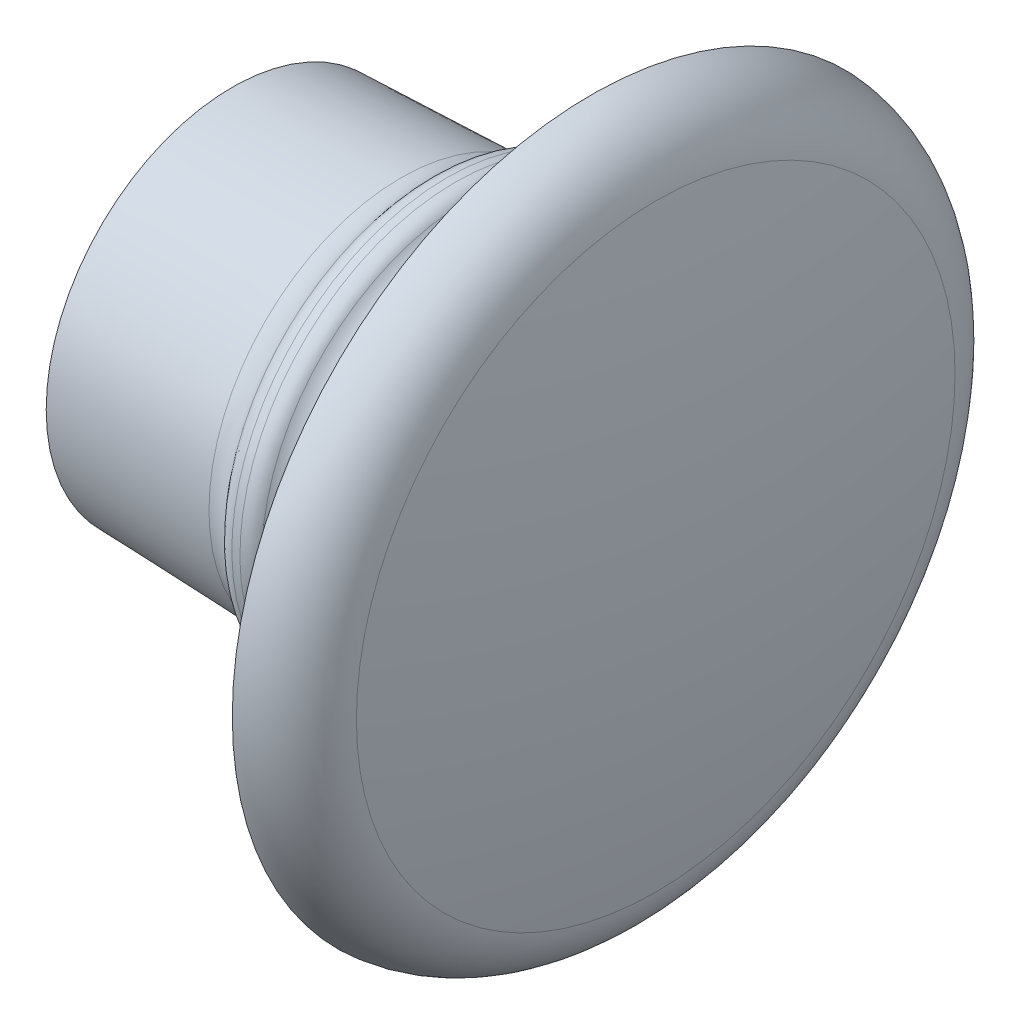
SolidWorks part; units mm, degrees
ref_plane "Plan1" through (0, 0, 0) normal (0, 0, 1) x (1, 0, 0)
ref_plane "Plan2" through (0, 0, 0) normal (0, 1, 0) x (1, 0, 0)
ref_plane "Plan3" through (0, 0, 0) normal (1, 0, 0) x (0, 0, -1)
sketch "Esquisse1" plane through (0, 0, 0) normal (1, 0, 0) x (0, 0, -1)
  circle A0 centre (0, 0) radius 5.35
  dimension "D1" = 10.7
extrude "Base-Extrusion" add sketch "Esquisse1" along normal blind 10
sketch "Esquisse7"
  line L0 (0, 0) -> (30, 0) construction
  line L1 (10, 10) -> (11.4898, 10)
  line L2 (10, 0) -> (10, 10)
  line L3 (12.5, 0) -> (10, 0)
  line L4 (10, -5.35) -> (10, 5.35) construction
  line L8 (10, 0) -> (0, 0) construction
  arc A0 (11.4898, 10) -> (12.5, 0) centre (-37.5, 0) cw
revolve "Boss.-Révol.1" add sketch "Esquisse5" angle 360 about L0
sketch "Esquisse5" plane through (0, 0, 0) normal (0, 0, 1) x (1, 0, 0)
  line L0 (-2.7996, 0) -> (20, 0) construction
  line L2 (-1.3, 0) -> (-1.5, 0) construction
  line L3 (10, 5.35) -> (0, 5.35) construction
  line L4 (10, 5.35) -> (7.5, 5.35)
  line L5 (4.7, 5.35) -> (0, 5.35)
  line L6 (0, 5.35) -> (0, 0)
  line L8 (10, -7.95) -> (10, 7.95) construction
  line L9 (0, 5.35) -> (0, -5.35) construction
  line L10 (10, 0) -> (10, 5.35)
  line L11 (10, 0) -> (0, 0)
  line L13 (5.7037, 6) -> (6.4963, 6)
  arc A1 (6.4, 6.45) -> (7.5, 5.35) centre (7.5, 6.45) ccw construction
  arc A3 (6.4963, 6) -> (7.5, 5.35) centre (7.5, 6.45) ccw
  arc A5 (4.7, 5.35) -> (5.8, 6.45) centre (4.7, 6.45) ccw construction
  arc A6 (4.7, 5.35) -> (5.7037, 6) centre (4.7, 6.45) ccw
  dimension "D1" = 6
revolve "Boss.-Révol.2" add sketch "Esquisse7" angle 360 about L0
sketch "Esquisse6" plane through (0, 0, 0) normal (0, 1, 0) x (1, 0, 0)
  line L0 (0, 0) -> (-17.5, 0) construction
  line L3 (11, 0) -> (0, 0)
  line L4 (0, 3.85) -> (10.8617, 3.6604)
  line L6 (0, 5.35) -> (0, -5.35) construction
  line L7 (10, 10) -> (10, -10) construction
  line L8 (4.7, 0) -> (0, 0) construction
  line L9 (0, 3.85) -> (0, 0)
  arc A0 (10.8617, 3.6604) -> (11, 0) centre (-37.5, 0) cw
  arc A1 (11.4898, -10) -> (11.4898, 10) centre (-37.5, 0) ccw construction
  dimension "D1" = 1
  dimension "D2" = 7.7
  dimension "D3" = 1
revolve "Enlèvement de matière-Révolution1" cut sketch "Esquisse6" angle 360 about L0
fillet "Congé11" radius 2
fillet "Congé12" radius 0.5
fillet "Congé13" radius 1
sketch "Esquisse8" plane through (0, 0, 0) normal (0, 0, 1) x (1, 0, 0)
  line L0 (0, 0) -> (15.0133, 0) construction
  line L1 (4.7, 0) -> (0, 0) construction
  line L2 (4.7, 5.35) -> (0, 5.1859)
  line L3 (0, 5.35) -> (0, -5.35) construction
  line L4 (0, 6.68) -> (0, 5.1859)
  line L5 (4.7, -5.35) -> (4.7, 5.35) construction
  line L6 (4.7, 5.35) -> (4.7, 6.68)
  line L7 (4.7, 6.68) -> (0, 6.68)
  arc A0 (4.7, 5.35) -> (5.5851, 5.7969) centre (4.7, 6.45) ccw construction
  dimension "D1" = 2
  dimension "D2" = 1.33
revolve "Enlèvement de matière-Révolution2" cut sketch "Esquisse8" angle 360 about L0
sketch "Esquisse9" plane through (0, 0, 0) normal (0, 0, 1) x (1, 0, 0)
  line L0 (10.2836, 6.2749) -> (10.3707, 6.1855)
  line L1 (10, 10) -> (10, -10) construction
  line L2 (10, 5.35) -> (7.5, 5.35) construction
  line L3 (10, 9.202) -> (10, 6.9727)
  line L4 (10, 5.35) -> (8.3169, 5.35)
  line L5 (10, 9.202) -> (8.4165, 9.202)
  line L6 (8.3169, 5.35) -> (8.4165, 9.202)
  line L8 (-1.4254, 0) -> (15.483, 0) construction
  line L9 (10, 0) -> (7.5, 0) construction
  arc A0 (10.3707, 6.1855) -> (10, 5.35) centre (10, 5.85) cw
  arc A1 (10.2836, 6.2749) -> (10, 6.9727) centre (11, 6.9727) cw
  point P10 (10, 6.5661)
  dimension "D1" = 1
  dimension "D2" = 0.5
revolve "Enlèvement de matière-Révolution3" cut sketch "Esquisse9" angle 360 about L8
